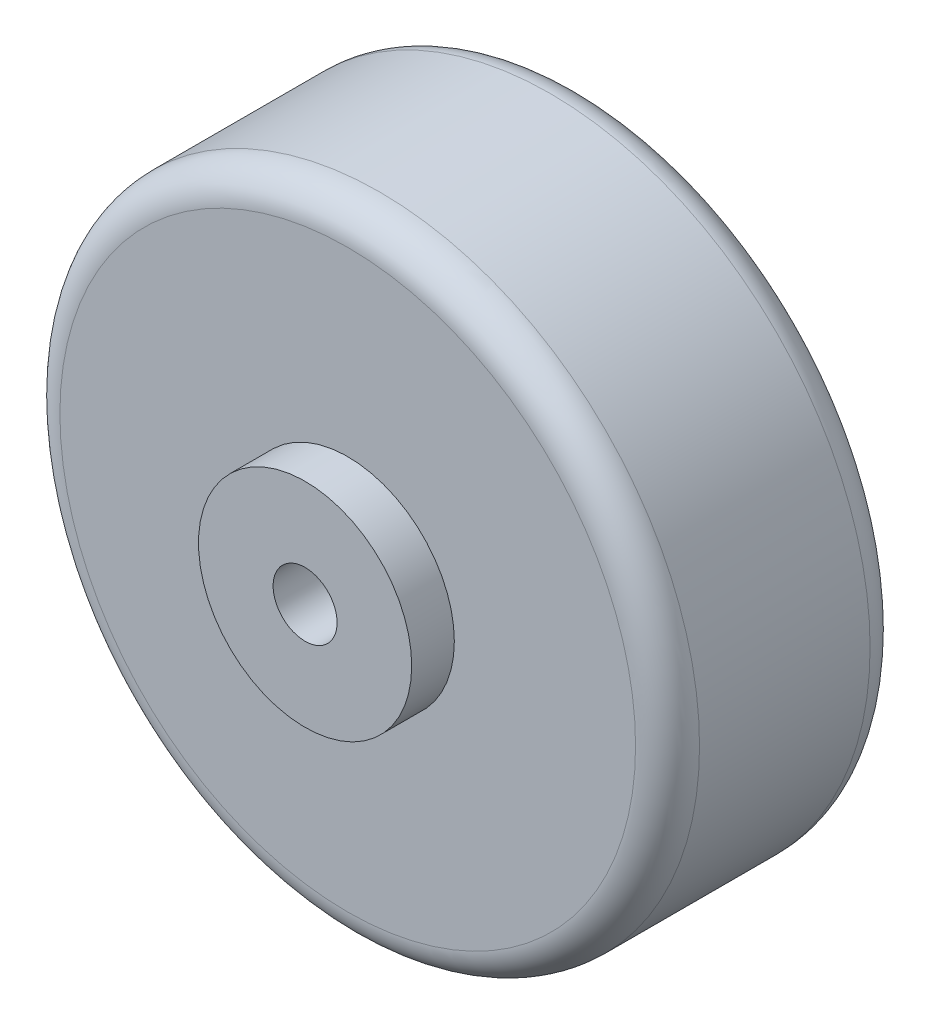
SolidWorks part; units mm, degrees
ref_plane "Plan de face" through (0, 0, 0) normal (0, 0, 1) x (1, 0, 0)
ref_plane "Plan de dessus" through (0, 0, 0) normal (0, 1, 0) x (1, 0, 0)
ref_plane "Plan de droite" through (0, 0, 0) normal (1, 0, 0) x (0, 0, -1)
sketch "Esquisse1" plane through (0, 0, 0) normal (0, 1, 0) x (1, 0, 0)
  line L0 (10, 15) -> (0, 15)
  line L1 (0, 15) -> (0, -15)
  line L2 (0, -15) -> (10, -15)
  line L3 (10, -15) -> (10, -11)
  line L4 (10, -11) -> (27, -11)
  line L5 (30, -8) -> (30, 8)
  line L6 (27, 11) -> (10, 11)
  line L7 (10, 11) -> (10, 15)
  line L8 (0, 15) -> (0, -15) construction
  arc A0 (27, -11) -> (30, -8) centre (27, -8) ccw
  arc A1 (30, 8) -> (27, 11) centre (27, 8) ccw
revolve "Révolution1" add sketch "Esquisse1" angle 360 about L8
sketch "Esquisse2" plane through (0, 0, 15) normal (0, 0, 1) x (1, 0, 0)
  circle A0 centre (0, 0) radius 3
  dimension "D1" = 6
extrude "Enlèv. mat.-Extru.1" cut sketch "Esquisse2" against normal through all
